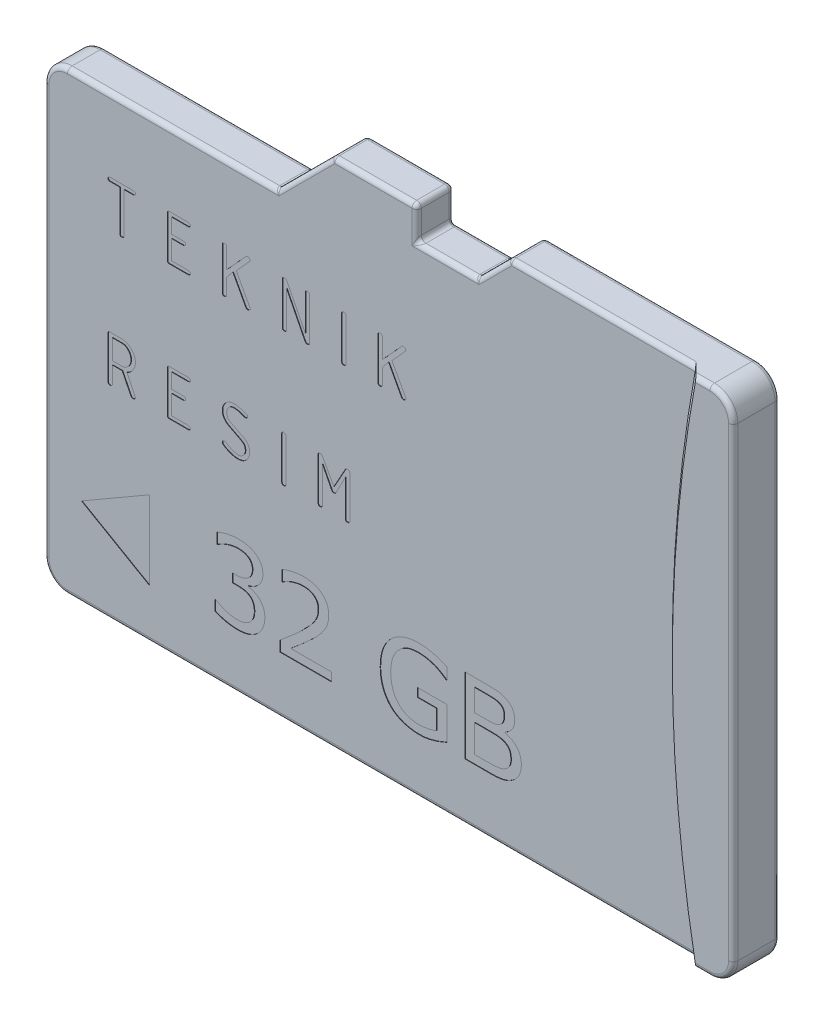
SolidWorks part; units mm, degrees
ref_plane "Ön Düzlem" through (0, 0, 0) normal (0, 0, 1) x (1, 0, 0)
ref_plane "Üst Düzlem" through (0, 0, 0) normal (0, 1, 0) x (1, 0, 0)
ref_plane "Sağ Düzlem" through (0, 0, 0) normal (1, 0, 0) x (0, 0, -1)
sketch "Sketch1" plane through (0, 0, 0) normal (0, 0, 1) x (1, 0, 0)
  line L0 (-15, 9.8) -> (-10, 9.8)
  line L1 (0, 0) -> (-15, 0)
  line L2 (0, 0) -> (0, 11)
  line L3 (0, 11) -> (-15, 11)
  line L4 (-15, 0) -> (-15, 11)
  line L5 (-10, 9.8) -> (-8.8, 11)
  line L6 (-8.8, 11) -> (-7, 11)
  line L7 (-7, 11) -> (-7, 10.3)
  line L8 (-7, 10.3) -> (-5.7, 10.3)
  line L9 (-5.7, 10.3) -> (-5, 11)
  dimension "D1" = 15
  dimension "D2" = 11
  dimension "D3" = 9.8
  dimension "D4" = 135
  dimension "D5" = 7
  dimension "D6" = 5
  dimension "D7" = 10.3
  dimension "D8" = 135
  dimension "D9" = 5
extrude "Boss-Extrude1" add sketch "Sketch1" along normal blind 0.8 contours L9 L8 L7 L3 L5 L0 L4 L1 L2
sketch "Sketch2" plane through (0, 0, 0.8) normal (0, 0, 1) x (1, 0, 0)
  line L0 (0, 0) -> (-15, 0) construction
  line L1 (0, 11) -> (-5, 11) construction
  line L2 (-1, 0) -> (0, 0)
  line L3 (0, 0) -> (0, 11)
  line L4 (0, 11) -> (-1, 11)
  arc A0 (-1, 0) -> (-1, 11) centre (28.4915, 5.5) cw
  dimension "D1" = 1
  dimension "30" = 30
  dimension "D2" = 1
extrude "Boss-Extrude2" add sketch "Sketch2" along normal blind 0.2
chamfer "Chamfer1" distance 0.2 angle 45 1 edges at (-1.5085, 5.5, 1)
fillet "Fillet1" radius 0.5 4 edges at (0, 11, 0.5) (0, 0, 0.5) (-15, 0, 0.4) (-15, 9.8, 0.4)
sketch "Sketch3" plane through (0, 0, 0.8) normal (0, 0, 1) x (1, 0, 0)
  line L0 (-12.7362, 1.907) -> (-12.7362, 2.7521)
  line L1 (-12.7362, 2.7521) -> (-14.2, 1.9061)
  line L2 (-14.2, 1.9061) -> (-12.7362, 1.0619)
  line L3 (-12.7362, 1.0619) -> (-12.7362, 1.907)
  line L4 (-15, 0.5) -> (-15, 9.3) construction
  dimension "D1" = 60
  dimension "D2" = 0.8
extrude "Cut-Extrude1" cut sketch "Sketch3" against normal blind 0.01
sketch "Sketch6" plane through (0, 0, 0.8) normal (0, 0, 1) x (1, 0, 0)
  text T0 "32 GB" font "Verdana" height in points 6
extrude "Cut-Extrude2" cut sketch "Sketch6" against normal blind 0.01
sketch "Sketch7" plane through (0, 0, 0) normal (0, 0, -1) x (-1, 0, 0)
  line L0 (14.5, 9.8) -> (10, 9.8) construction
  line L1 (11, 9.2) -> (14, 9.2)
  line L2 (11, 9.2) -> (11, 8.3)
  line L3 (11, 8.3) -> (14, 8.3)
  line L4 (14, 9.2) -> (14, 8.3)
  line L5 (15, 0.5) -> (15, 9.3) construction
  dimension "D1" = 3
  dimension "D2" = 0.9
  dimension "D3" = 0.6
  dimension "D4" = 1
extrude "Cut-Extrude3" cut sketch "Sketch7" against normal blind 0.01
pattern_linear "LPattern1" count 8 spacing 1.1 along (0, -1, 0) of "Cut-Extrude3"
sketch "Sketch8" plane through (0, 0, 0.01) normal (0, 0, -1) x (-1, 0, 0)
  line L0 (11, 5) -> (14, 5) construction
  line L1 (14, 5.9) -> (14.5, 5.9)
  line L2 (14, 5.9) -> (14, 5)
  line L3 (14, 5) -> (14.5, 5)
  line L4 (14.5, 5.9) -> (14.5, 5)
  line L5 (14, 3.7) -> (14.5, 3.7)
  line L6 (14, 3.7) -> (14, 2.8)
  line L7 (14, 2.8) -> (14.5, 2.8)
  line L8 (14.5, 3.7) -> (14.5, 2.8)
  line L9 (11, 2.8) -> (14, 2.8) construction
  dimension "D1" = 0.5
extrude "Cut-Extrude5" cut sketch "Sketch8" along normal blind 0.1
fillet "Fillet2" radius 0.1 10 edges at (-12.25, 9.8, 0.8) (-14.8536, 9.6536, 0.8) (-15, 4.9, 0.8) (-7.9, 11, 0.8) (-7, 10.65, 0.8) (-6.35, 10.3, 0.8) (-5.35, 10.65, 0.8) (-9.4, 10.4, 0.8) (-14.8536, 0.1464, 0.8)
fillet "Fillet3" radius 0.1 13 edges at (-7.9, 11, 0) (-0.1464, 10.8536, 0) (0, 5.5, 0) (-0.1464, 0.1464, 0) (-12.25, 9.8, 0) (-14.8536, 9.6536, 0) (-15, 4.9, 0) (-14.8536, 0.1464, 0) (-5.35, 10.65, 0) (-6.35, 10.3, 0) (-7, 10.65, 0) (-9.4, 10.4, 0) (-7.5, 0, 0)
fillet "Fillet4" radius 0.1 18 edges at (-10, 9.8, 0.4) (-5, 11, 0.4) (-7, 11, 0.4) (-7, 10.3, 0.4) (-5.7, 10.3, 0.4) (-8.8, 11, 0.4) (-4.9879, 10.9707, 0.7707) (-5.6879, 10.2707, 0.7707) (-7.0293, 10.2707, 0.7707) (-7.0293, 10.9707, 0.7707) (-8.7879, 10.9707, 0.7707) (-9.9879, 9.7707, 0.7707) (-9.9879, 9.7707, 0.0293) (-8.7879, 10.9707, 0.0293) (-7.0293, 10.9707, 0.0293) (-7.0293, 10.2707, 0.0293) (-5.6879, 10.2707, 0.0293) (-4.9879, 10.9707, 0.0293)
fillet "Fillet6" radius 0.1 5 edges at (-0.6483, 0, 1) (-0.1464, 0.1464, 1) (0, 5.5, 1) (-0.1464, 10.8536, 1) (-0.6483, 11, 1)
sketch "Sketch9" plane through (0, 0, 0.8) normal (0, 0, 1) x (1, 0, 0)
  text T0 "TEKNIK   RESIM" font "SWIsop2" height in points 4
extrude "Cut-Extrude6" cut sketch "Sketch9" against normal blind 0.01
